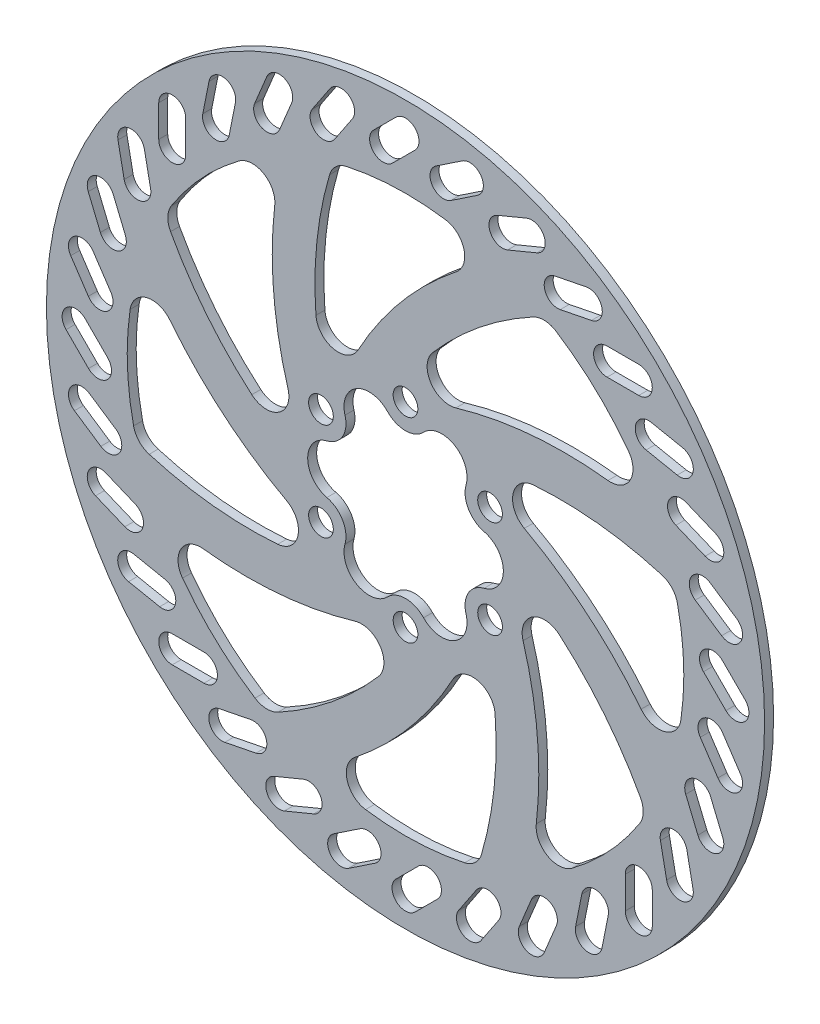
SolidWorks part; units mm, degrees
ref_plane "Plan1" through (0, 0, 0) normal (0, 0, 1) x (1, 0, 0)
ref_plane "Plan2" through (0, 0, 0) normal (0, 1, 0) x (1, 0, 0)
ref_plane "Plan3" through (0, 0, 0) normal (1, 0, 0) x (0, 0, -1)
sketch "Esquisse1" plane through (0, 0, 0) normal (0, 0, 1) x (1, 0, 0)
  circle A0 centre (0, 0) radius 80
  dimension "D1" = 160
extrude "Base-Extrusion" add sketch "Esquisse1" along normal blind 2
sketch "Esquisse2" plane through (0, 0, 2) normal (0, 0, 1) x (1, 0, 0)
  circle A0 centre (0, 0) radius 15
  dimension "D1" = 30
extrude "Enlèv. mat.-Extru.1" cut sketch "Esquisse2" against normal through all
sketch "Esquisse3" plane through (0, 0, 2) normal (0, 0, 1) x (1, 0, 0)
  line L0 (0, 90) -> (0, -90) construction
  circle A0 centre (0, -21.75) radius 2.75
  dimension "D1" = 5.5
  dimension "D2" = 21.75
extrude "Enlèv. mat.-Extru.2" cut sketch "Esquisse3" against normal through all
pattern_circular "Répétition circulaire1" count 6 over 360
sketch "Esquisse4" plane through (0, 0, 2) normal (0, 0, 1) x (1, 0, 0)
  line L0 (0, 90) -> (0, -90) construction
  line L1 (-50, 86.6025) -> (0, 0) construction
  line L2 (0, 0) -> (-18.8361, 10.875) construction
  line L3 (0, 16.175) -> (0, 12.5)
  line L4 (-14.008, 8.0875) -> (-10.8253, 6.25)
  arc A0 (-14.008, 8.0875) -> (-13.4838, 12.4351) centre (-18.8361, 10.875) ccw
  circle A1 centre (0, 0) radius 15 construction
  arc A2 (-4.0272, 17.8948) -> (0, 16.175) centre (0, 21.75) ccw
  circle A3 centre (0, 21.75) radius 2.75 construction
  arc A4 (-4.0272, 17.8948) -> (-13.4838, 12.4351) centre (-8.0875, 14.008) ccw
  circle A5 centre (-18.8361, 10.875) radius 2.75 construction
  arc A7 (0, 12.5) -> (-10.8253, 6.25) centre (0, 0) ccw
  dimension "D2" = 25
  dimension "D3" = 5.575
  dimension "D4" = 5.575
  dimension "D5" = 5.6208
  dimension "D1" = 30
extrude "Enlèv. mat.-Extru.3" cut sketch "Esquisse4" against normal through all
pattern_circular "Répétition circulaire2" count 6 over 360
sketch "Esquisse5" plane through (0, 0, 2) normal (0, 0, 1) x (1, 0, 0)
  line L0 (0, 87) -> (0, 0) construction
  line L1 (0, 0) -> (92, 0) construction
  arc A0 (49.6817, 37.0908) -> (33.5171, 52.1594) centre (0, 0) ccw
  arc A1 (11.2317, 26.1896) -> (6.0203, 34.2437) centre (9.8114, 30.9836) cw
  arc A2 (11.2317, 26.1896) -> (45.1029, 29.1325) centre (35.3761, -55.3092) cw
  arc A3 (6.0203, 34.2437) -> (28.4232, 52.3443) centre (66.6777, -17.9166) cw
  circle A4 centre (0, 0) radius 27.5 construction
  arc A6 (33.5171, 52.1594) -> (28.4232, 52.3443) centre (30.8141, 47.953) ccw
  arc A7 (45.1029, 29.1325) -> (49.6817, 37.0908) centre (45.6751, 34.0996) ccw
  dimension "D1" = 80
  dimension "D2" = 85
  dimension "D3" = 62
  dimension "D4" = 5
  dimension "D5" = 5
  dimension "D6" = 5
  dimension "D8" = 55
extrude "Enlèv. mat.-Extru.4" cut sketch "Esquisse5" against normal through all
pattern_circular "Répétition circulaire3" count 8 over 360
sketch "Esquisse6" plane through (0, 0, 2) normal (0, 0, 1) x (1, 0, 0)
  line L0 (0, 87) -> (0, -87) construction
  line L1 (0, 73.5) -> (-5, 68.5) construction
  line L2 (-2.1213, 75.6213) -> (-7.1213, 70.6213)
  line L3 (2.1213, 71.3787) -> (-2.8787, 66.3787)
  arc A0 (2.1213, 71.3787) -> (-2.1213, 75.6213) centre (0, 73.5) ccw
  arc A1 (-7.1213, 70.6213) -> (-2.8787, 66.3787) centre (-5, 68.5) ccw
  arc A3 (61.3574, -8.9031) -> (60.5824, 13.1821) centre (0, 0) ccw construction
  dimension "D1" = 6
  dimension "D4" = 68.5
  dimension "D5" = 135
  dimension "D2" = 73.5
extrude "Enlèv. mat.-Extru.5" cut sketch "Esquisse6" against normal through all
pattern_circular "Répétition circulaire4" count 32 over 360
